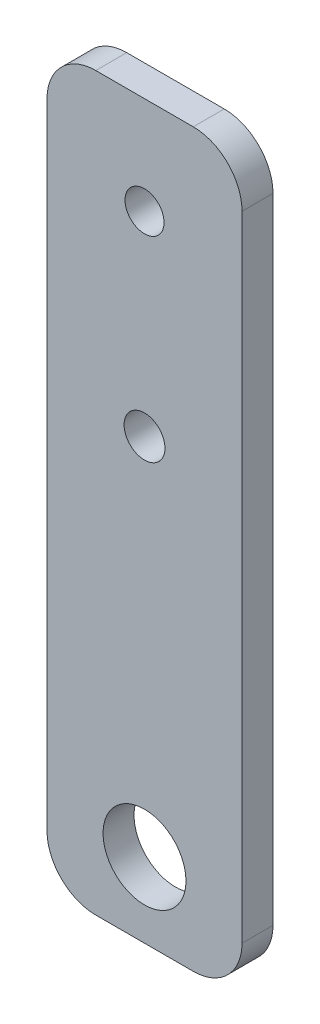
SolidWorks part; units mm, degrees
ref_plane "Front Plane" through (0, 0, 0) normal (0, 0, 1) x (1, 0, 0)
ref_plane "Top Plane" through (0, 0, 0) normal (0, 1, 0) x (1, 0, 0)
ref_plane "Right Plane" through (0, 0, 0) normal (1, 0, 0) x (0, 0, -1)
sketch "Sketch1" plane through (0, 0, 0) normal (0, 0, 1) x (1, 0, 0)
  line L1 (10, 0) -> (-10, 0)
  line L2 (10, 0) -> (10, -20)
  line L3 (10, -20) -> (-10, -20)
  line L4 (-10, 0) -> (-10, -20)
  line L5 (10, 0) -> (-10, -20) construction
  line L6 (10, -20) -> (-10, 0) construction
  line L7 (10, 0) -> (-10, 0)
  line L8 (10, 0) -> (10, 20)
  line L9 (10, 20) -> (-10, 20)
  line L10 (-10, 0) -> (-10, 20)
  line L11 (10, -20) -> (-10, -20)
  line L12 (10, -20) -> (10, -55)
  line L13 (10, -55) -> (-10, -55)
  line L14 (-10, -20) -> (-10, -55)
  circle A1 centre (0, -10) radius 2.095
  circle A5 centre (0, -47.35) radius 4.25
  circle A6 centre (0, 10) radius 2
  dimension "D5" = 8.5
  dimension "D6" = 10
  dimension "D7" = 10
  dimension "D8" = 4
  dimension "D9" = 10
  dimension "D10" = 7.65
  dimension "D1" = 20
  dimension "D2" = 20
  dimension "D3" = 20
  dimension "D4" = 35
extrude "Boss-Extrude1" add sketch "Sketch1" along normal blind 3.175 contours L10 L1 L8 L9 A6 | L1 L4 L3 L2 A1 | L3 L14 L13 L12 A5
fillet "Fillet1" radius 5 4 edges at (-10, -55, 1.5875) (10, -55, 1.5875) (-10, 20, 1.5875) (10, 20, 1.5875)
